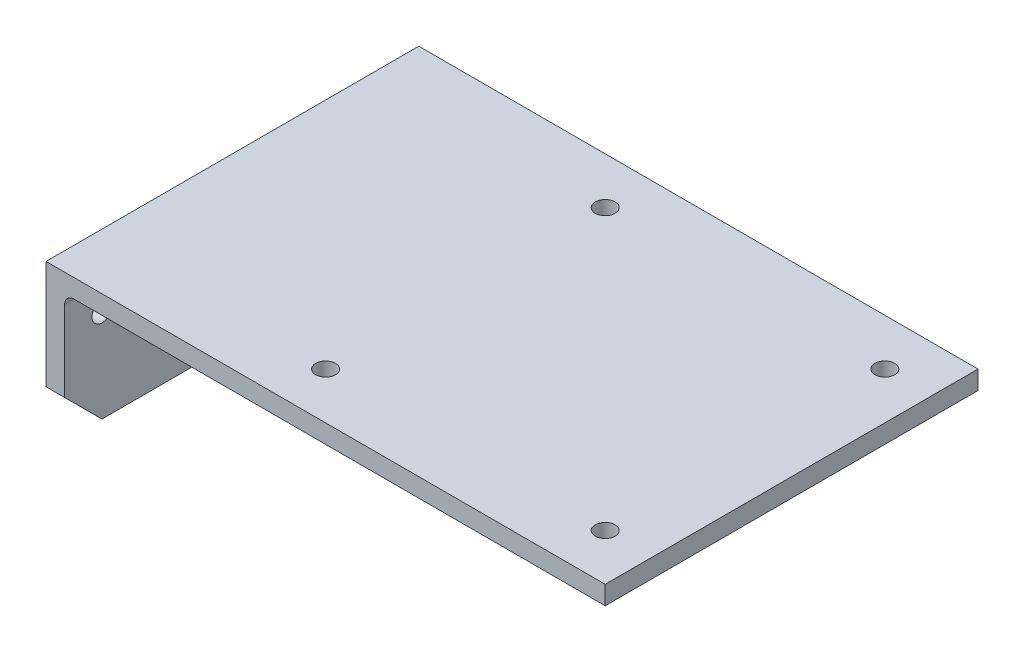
SolidWorks part; units mm, degrees
ref_plane "Front Plane" through (0, 0, 0) normal (0, 0, 1) x (1, 0, 0)
ref_plane "Top Plane" through (0, 0, 0) normal (0, 1, 0) x (1, 0, 0)
ref_plane "Right Plane" through (0, 0, 0) normal (1, 0, 0) x (0, 0, -1)
sketch "Sketch1" plane through (0, 0, 0) normal (0, 0, 1) x (1, 0, 0)
  line L0 (-63.5, 0) -> (63.5, 0) construction
  line L1 (-127, 0) -> (63.5, 0)
  line L2 (-127, 382.1188) -> (-127, -49.6812) construction
  line L3 (-127, 0) -> (-127, -49.6812)
  line L4 (-120.65, -6.35) -> (-120.65, -49.6812)
  line L5 (-120.65, -6.35) -> (63.5, -6.35)
  line L6 (63.5, 0) -> (63.5, -6.35)
  line L7 (-127, -49.6812) -> (-120.65, -49.6812)
  dimension "D1" = 6.35
extrude "Extrude1" add sketch "Sketch1" against normal up to surface (127 mm away)
sketch "Sketch2" plane through (0, -6.35, 0) normal (0, -1, 0) x (1, 0, 0)
  circle A0 centre (47.625, -111.125) radius 3.175 construction
  circle A1 centre (47.625, -111.125) radius 3.175 construction
  circle A2 centre (47.625, -15.875) radius 3.175 construction
  circle A3 centre (47.625, -15.875) radius 3.175 construction
  circle A4 centre (-47.625, -15.875) radius 3.175 construction
  circle A5 centre (-47.625, -15.875) radius 3.175 construction
  circle A6 centre (-47.625, -111.125) radius 3.175 construction
  circle A7 centre (-47.625, -111.125) radius 3.175 construction
  circle A8 centre (-47.625, -111.125) radius 3.375
  circle A9 centre (47.625, -111.125) radius 3.375
  circle A10 centre (47.625, -15.875) radius 3.375
  circle A11 centre (-47.625, -15.875) radius 3.375
  dimension "D1" = 0.2
  dimension "D2" = 0.2
  dimension "D3" = 0.2
extrude "Cut-Extrude1" cut sketch "Sketch2" against normal blind 10
sketch "Sketch3" plane through (-120.65, 0, 0) normal (1, 0, 0) x (0, 0, -1)
  line L0 (63.5, -49.6812) -> (63.5, 0) construction
  line L1 (127, -49.6812) -> (0, -49.6812) construction
  line L2 (127, 0) -> (0, 0) construction
  circle A0 centre (12.7, -17.9312) radius 3.3782
  circle A1 centre (63.5, -36.9812) radius 3.3782
  circle A2 centre (114.3, -17.9312) radius 3.3782
  dimension "D1" = 6.7564
  dimension "D2" = 101.6
  dimension "D3" = 19.05
  dimension "D4" = 12.7
extrude "Cut-Extrude2" cut sketch "Sketch3" against normal through all
chamfer "Chamfer1" distance 12.7 angle 45 2 edges at (-123.825, -49.6812, -127) (-123.825, -49.6812, 0)
fillet "Fillet1" radius 3.175 1 edges at (-120.65, -6.35, -63.5)
